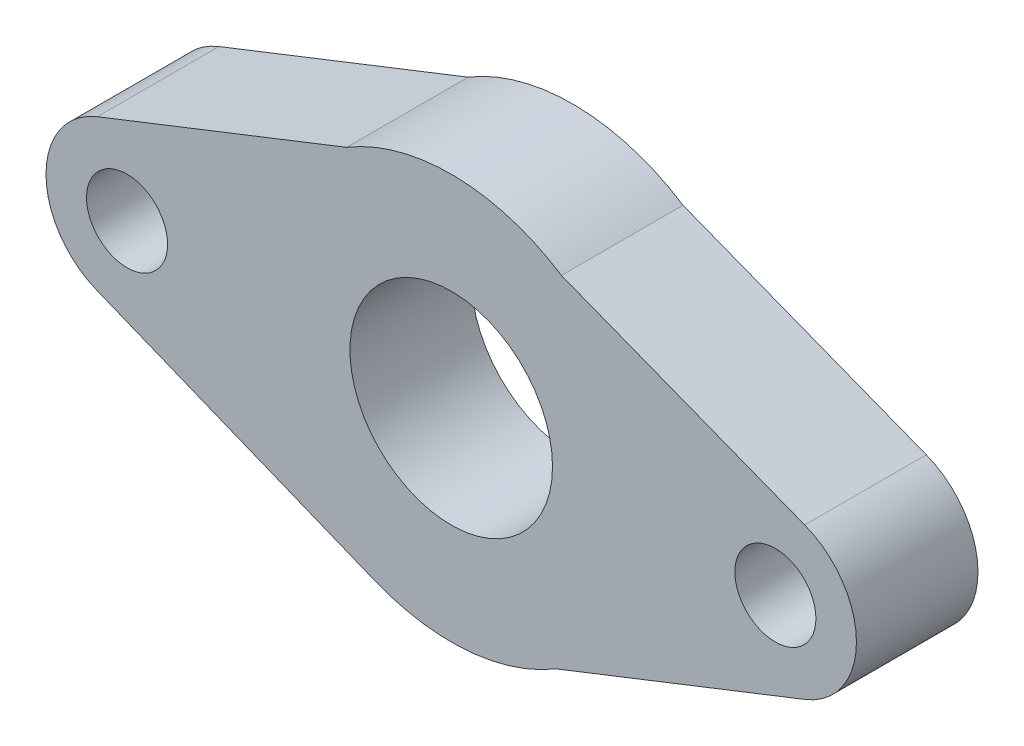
SolidWorks part; units mm, degrees
ref_plane "Plano frontal" through (0, 0, 0) normal (0, 0, 1) x (1, 0, 0)
ref_plane "Plano superior" through (0, 0, 0) normal (0, 1, 0) x (1, 0, 0)
ref_plane "Plano direito" through (0, 0, 0) normal (1, 0, 0) x (0, 0, -1)
sketch "Esboço1" plane through (0, 0, 0) normal (0, 0, 1) x (1, 0, 0)
  line L2 (-43.6623, 9.3052) -> (-12.9104, 21.4084)
  line L3 (-43.7499, -9.2703) -> (-9.5312, -23.1118)
  line L4 (12.9104, -21.4084) -> (43.6623, -9.3052)
  line L5 (43.619, 9.3222) -> (13.6043, 20.9743)
  arc A0 (-9.5312, -23.1118) -> (12.9104, -21.4084) centre (0, 0) ccw
  arc A1 (-43.6623, 9.3052) -> (-43.7499, -9.2703) centre (-40, 0) ccw
  arc A2 (43.6623, -9.3052) -> (43.619, 9.3222) centre (40, 0) ccw
  arc A3 (13.6043, 20.9743) -> (-12.9104, 21.4084) centre (0, 0) ccw
  circle A4 centre (-40, 0) radius 5
  circle A5 centre (0, 0) radius 12.5
  circle A6 centre (40, 0) radius 5
  point P12 (0, 0)
  dimension "D1" = 50
  dimension "D4" = 20
  dimension "D5" = 20
  dimension "D6" = 10
  dimension "D7" = 10
  dimension "D8" = 25
  dimension "D2" = 40
  dimension "D3" = 40
extrude "Ressalto-extrusão1" add sketch "Esboço1" along normal blind 15
